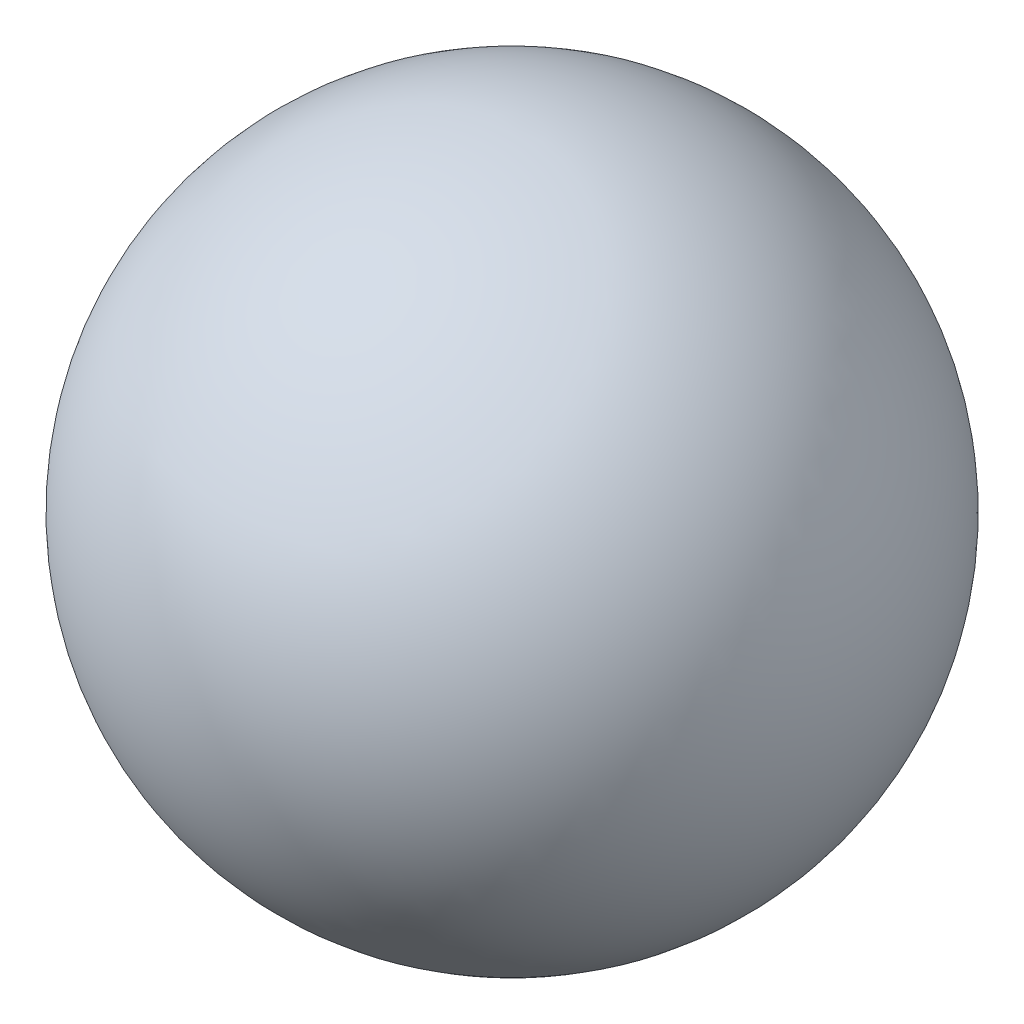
SolidWorks part; units mm, degrees
ref_plane "Plan de face" through (0, 0, 0) normal (0, 0, 1) x (1, 0, 0)
ref_plane "Plan de dessus" through (0, 0, 0) normal (0, 1, 0) x (1, 0, 0)
ref_plane "Plan de droite" through (0, 0, 0) normal (1, 0, 0) x (0, 0, -1)
sketch "Esquisse1" plane through (0, 0, 0) normal (0, 1, 0) x (1, 0, 0)
  line L0 (0, 28.2127) -> (0, -30.8618) construction
  line L1 (30.4644, 0) -> (-21.7225, 0) construction
  line L2 (0, 10) -> (0, -10)
  arc A0 (0, 10) -> (0, -10) centre (0, 0) cw
  dimension "D1" = 10
revolve "Révolution1" add sketch "Esquisse1" angle 360 about L0
hole_wizard "Diamètre du perçage M10.0 (10.000000)1" positions "Esquisse3D1" profile "Esquisse3" hole size "M10.0" standard "ISO"
sketch3d "Esquisse3D1"
  point P0 (-0.0044, -10, 0)
sketch "Esquisse3" plane through (-0.0044, -10, 0) normal (0, 0, 1) x (1, -0.0004, 0)
  line L0 (0, 0) -> (0, 19.0043)
  line L1 (0, 19.0043) -> (5, 16)
  line L2 (5, 16) -> (5, 0)
  line L5 (5, 0) -> (0, 0)
  line L10 (0, 19.0043) -> (-5, 16) construction
  line L11 (0, -6.35) -> (0, 107.95) construction
  dimension "Diamètre du perçage" = 10
  dimension "Profondeur du perçage" = 16
  dimension "Angle de pointe" = 118
